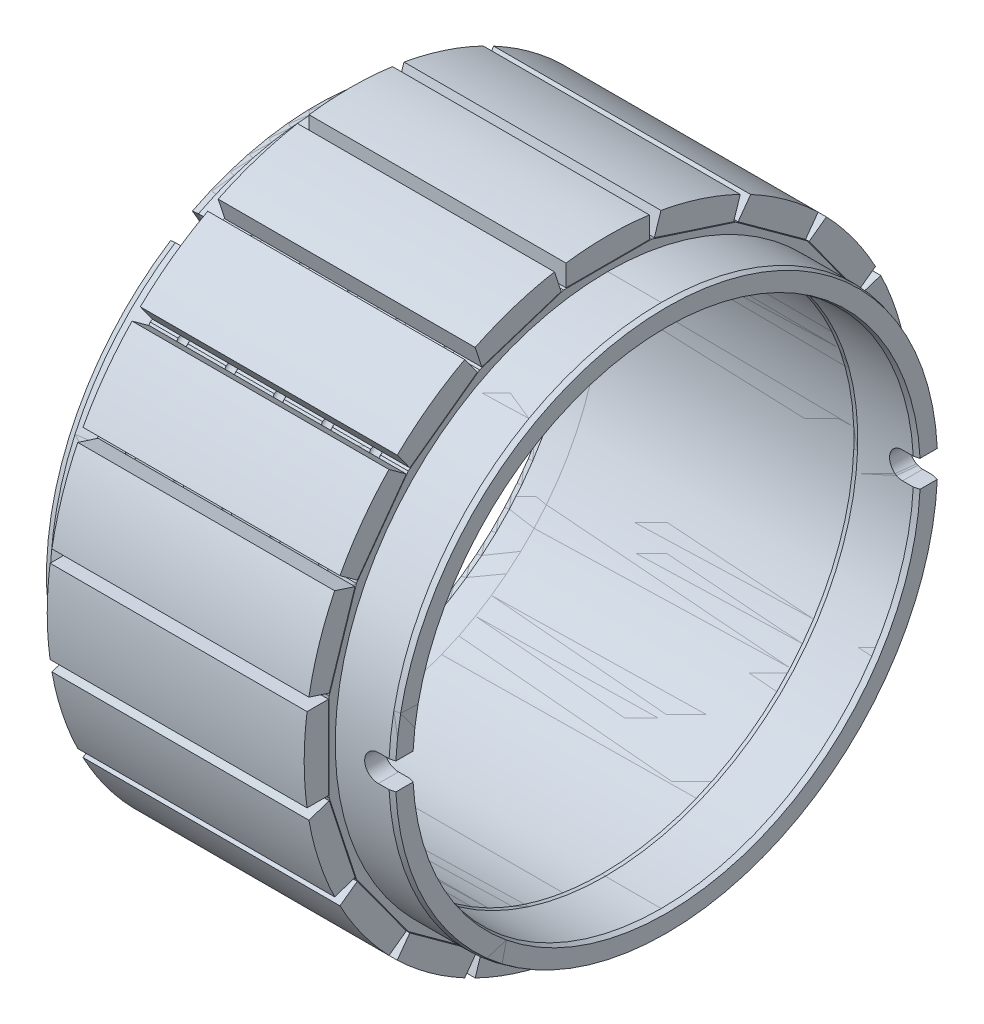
SolidWorks part; units mm, degrees
ref_plane "Front Plane" through (0, 0, 0) normal (0, 0, 1) x (1, 0, 0)
ref_plane "Top Plane" through (0, 0, 0) normal (0, 1, 0) x (1, 0, 0)
ref_plane "Right Plane" through (0, 0, 0) normal (1, 0, 0) x (0, 0, -1)
imported_body "STEP_759875.stp<1>"
ref_plane "Plane1" through (-39.15, 0, 0) normal (1, 0, 0) x (0, 0, -1)
sketch "Sketch1" plane through (-39.15, 0, 0) normal (1, 0, 0) x (0, 0, -1)
  line L1 (-44.0817, -39.0317) -> (50.4477, -39.0317)
  line L2 (-44.0817, -39.0317) -> (-44.0817, 38.969)
  line L3 (-44.0817, 38.969) -> (50.4477, 38.969)
  line L4 (50.4477, -39.0317) -> (50.4477, 38.969)
extrude "Jons Cut" cut sketch "Sketch1" against normal blind 1
equation "\"Buoyancy\"=\"SW-Volume\"*(\"SW-Density\"-.037062)"
